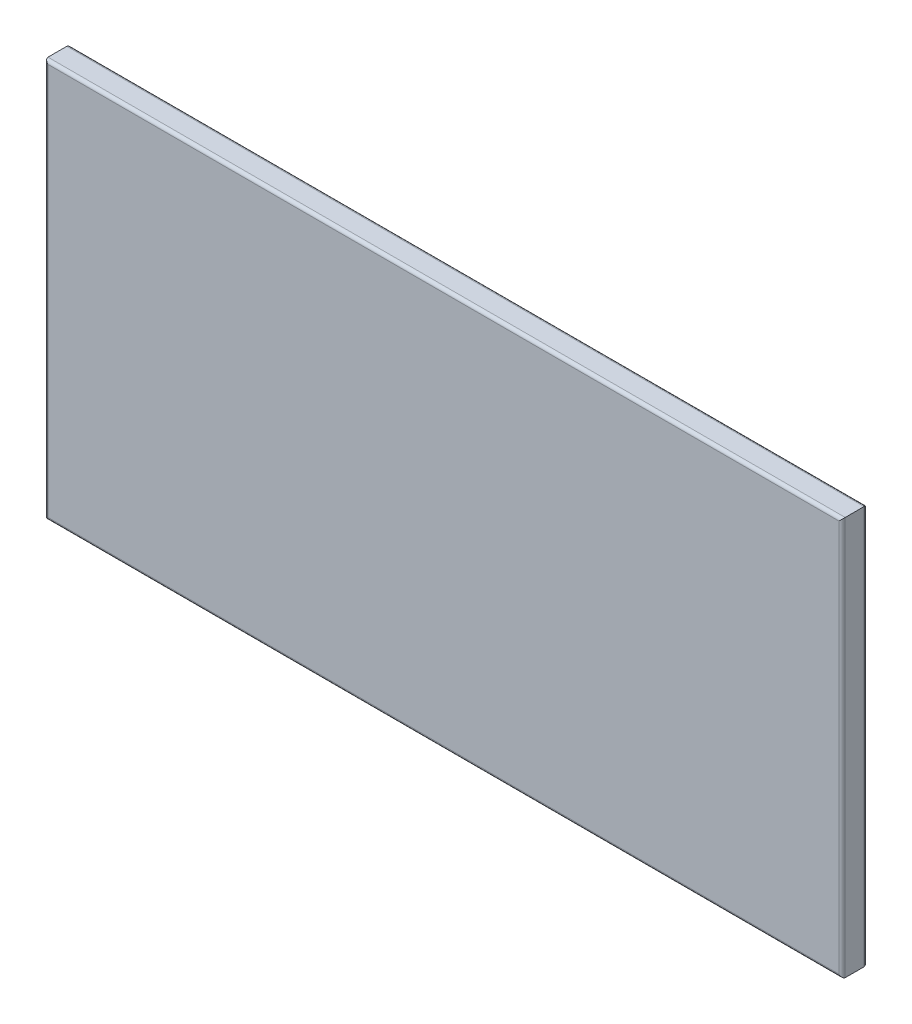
SolidWorks part; units mm, degrees
ref_plane "Ebene vorne" through (0, 0, 0) normal (0, 0, 1) x (1, 0, 0)
ref_plane "Ebene oben" through (0, 0, 0) normal (0, 1, 0) x (1, 0, 0)
ref_plane "Ebene rechts" through (0, 0, 0) normal (1, 0, 0) x (0, 0, -1)
sketch "Skizze1" plane through (0, 0, 0) normal (0, 0, 1) x (1, 0, 0)
  line L1 (-31.8, -15.9) -> (31.8, -15.9)
  line L2 (-31.8, -15.9) -> (-31.8, 15.9)
  line L3 (-31.8, 15.9) -> (31.8, 15.9)
  line L4 (31.8, -15.9) -> (31.8, 15.9)
  line L5 (-31.8, -15.9) -> (31.8, 15.9) construction
  line L6 (-31.8, 15.9) -> (31.8, -15.9) construction
  point P0 (0, 0)
  dimension "D1" = 31.8
  dimension "D2" = 63.6
extrude "Aufsatz-Linear austragen1" add sketch "Skizze1" along normal blind 2
fillet "Verrundung1" radius 0.25 8 edges at (0, 15.9, 0) (-31.8, 0, 0) (0, -15.9, 0) (31.8, 0, 0) (0, -15.9, 2) (-31.8, 0, 2) (0, 15.9, 2) (31.8, 0, 2)
